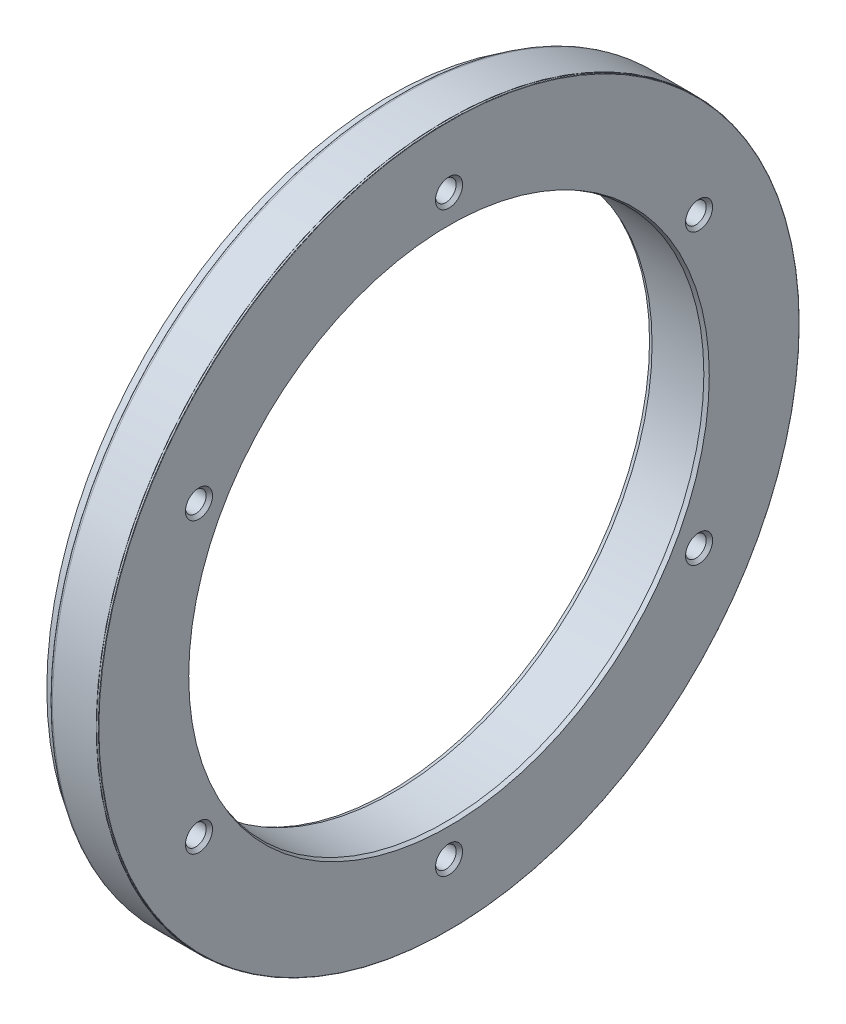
SolidWorks part; units mm, degrees
ref_plane "Front Plane" through (0, 0, 0) normal (0, 0, 1) x (1, 0, 0)
ref_plane "Top Plane" through (0, 0, 0) normal (0, 1, 0) x (1, 0, 0)
ref_plane "Right Plane" through (0, 0, 0) normal (1, 0, 0) x (0, 0, -1)
imported_body "Obroc_130 za lepljenje-1-solid1"
imported_body "Feritte_176-1-solid1"
imported_body "pokrivna folija_za 176_12-1-solid1"
other "Intersect1"
